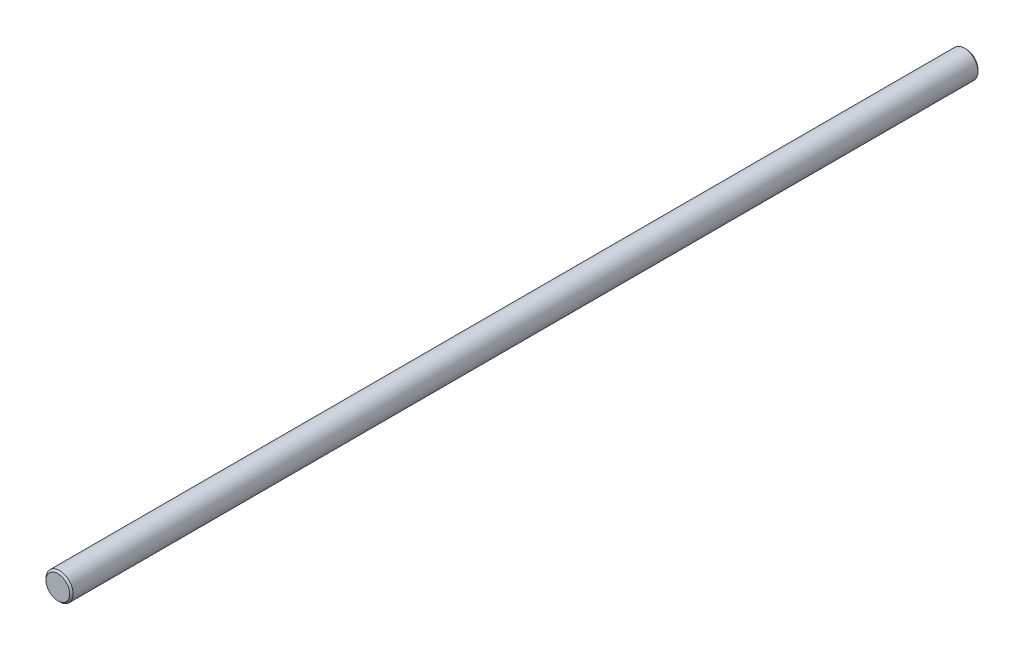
SolidWorks part; units mm, degrees
ref_plane "Спереди" through (0, 0, 0) normal (0, 0, 1) x (1, 0, 0)
ref_plane "Сверху" through (0, 0, 0) normal (0, 1, 0) x (1, 0, 0)
ref_plane "Справа" through (0, 0, 0) normal (1, 0, 0) x (0, 0, -1)
ref_plane "Плоскость4" through (0, 0, -267) normal (0, 0, -1) x (-1, 0, 0)
sketch "Эскиз1" plane through (0, 0, -267) normal (0, 0, -1) x (-1, 0, 0)
  circle A0 centre (0, 0) radius 4
  dimension "D1" = 8
extrude "Бобышка-Вытянуть1" add sketch "Эскиз1" against normal blind 268
chamfer "Фаска1" distance 0.5 angle 45 2 edges at (4, 0, 1) (4, 0, -267)
